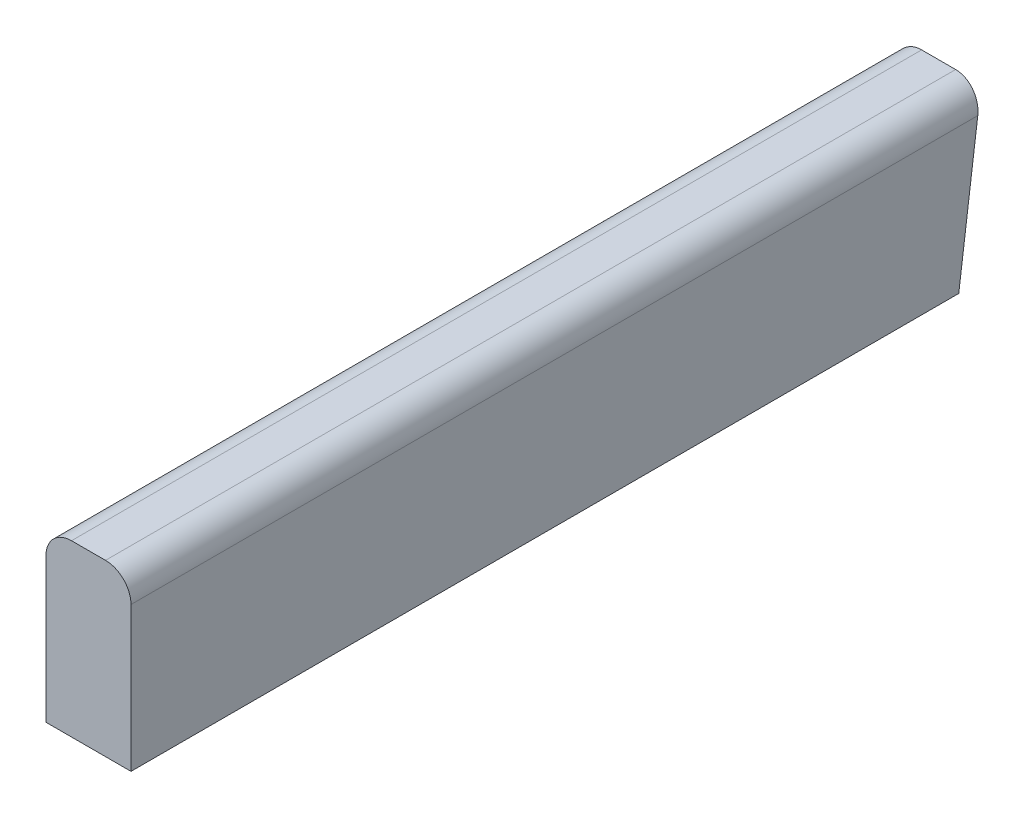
SolidWorks part; units mm, degrees
ref_plane "Ebene vorne" through (0, 0, 0) normal (0, 0, 1) x (1, 0, 0)
ref_plane "Ebene oben" through (0, 0, 0) normal (0, 1, 0) x (1, 0, 0)
ref_plane "Ebene rechts" through (0, 0, 0) normal (1, 0, 0) x (0, 0, -1)
sketch "Skizze1" plane through (0, 0, 0) normal (0, 0, 1) x (1, 0, 0)
  line L1 (0, 0) -> (10, 0)
  line L2 (0, 0) -> (0, 17)
  line L3 (3, 20) -> (7, 20)
  line L4 (10, 0) -> (10, 17)
  arc A0 (0, 17) -> (3, 20) centre (3, 17) cw
  arc A1 (10, 17) -> (7, 20) centre (7, 17) ccw
  point P7 (0, 20)
  dimension "D3" = 3
  dimension "D1" = 10
  dimension "D2" = 20
extrude "Linear austragen1" add sketch "Skizze1" along normal blind 100
sketch "Skizze2" plane through (10, 0, 0) normal (1, 0, 0) x (0, 0, -1)
  line L0 (0, 20) -> (-2.633, 0)
  line L1 (-100, 0) -> (0, 0) construction
  line L2 (-2.633, 0) -> (0, 0)
  line L3 (0, 0) -> (0, 20)
  dimension "D1" = 7.5
extrude "Schnitt-Linear austragen1" cut sketch "Skizze2" against normal through all
